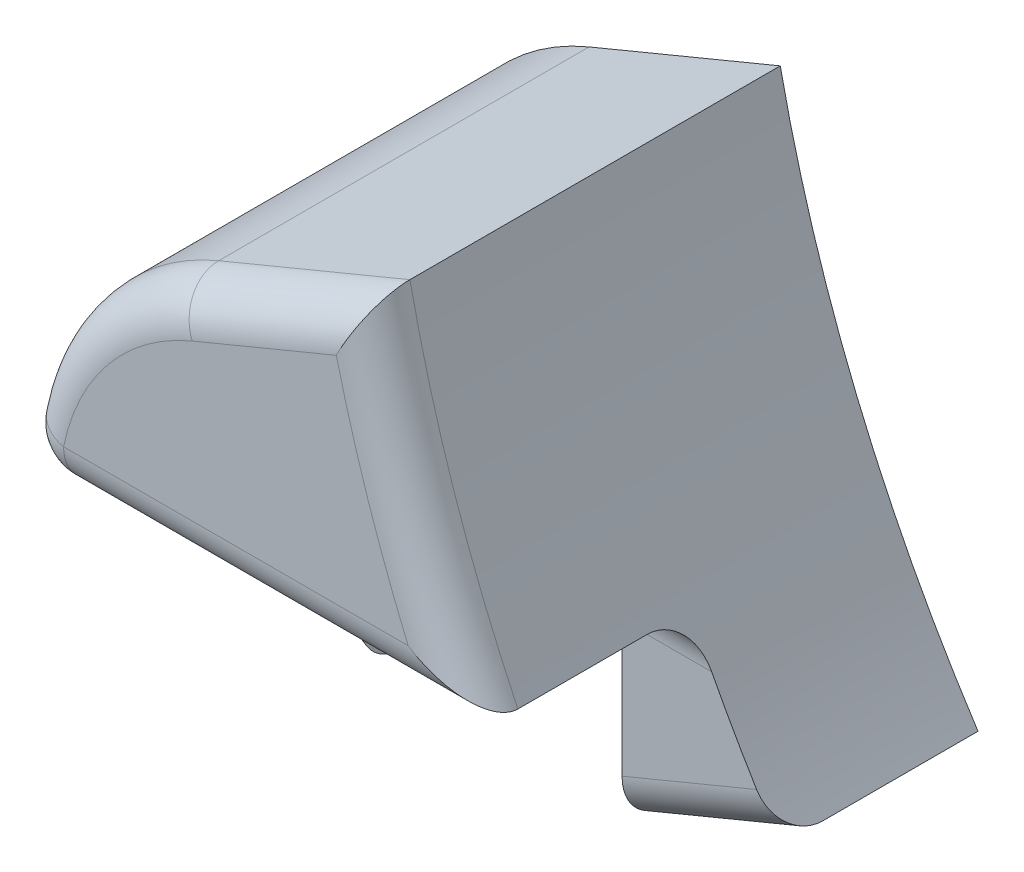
SolidWorks part; units mm, degrees
other "<AntiRotation2>-<Fillet2>"
ref_plane "Front Plane" through (0, 0, 0) normal (0, 0, 1) x (1, 0, 0)
ref_plane "Top Plane" through (0, 0, 0) normal (0, 1, 0) x (1, 0, 0)
ref_plane "Right Plane" through (0, 0, 0) normal (1, 0, 0) x (0, 0, -1)
mirrored part "AntiRotation2_Mirrored"
